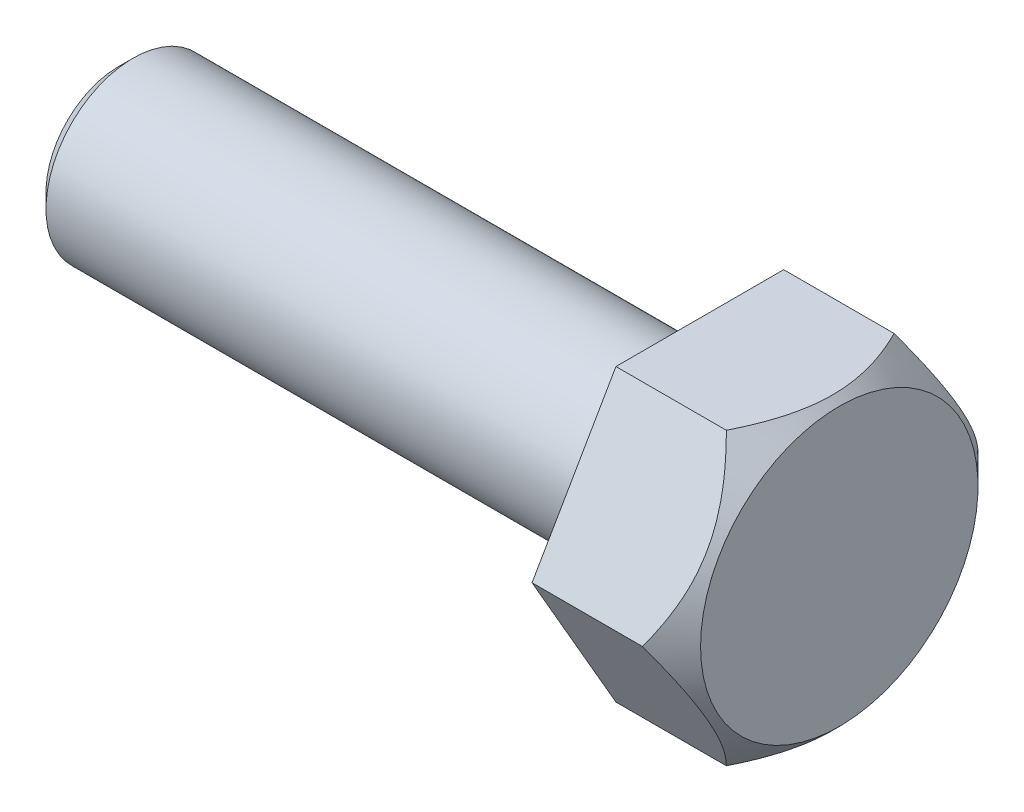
SolidWorks part; units mm, degrees
ref_plane "Plane1" through (0, 0, 0) normal (0, 0, 1) x (1, 0, 0)
ref_plane "Plane2" through (0, 0, 0) normal (0, 1, 0) x (1, 0, 0)
ref_plane "Plane3" through (0, 0, 0) normal (1, 0, 0) x (0, 0, -1)
sketch "Esquisse4" plane through (0, 0, 0) normal (1, 0, 0) x (0, 0, -1)
  circle A0 centre (0, 0) radius 3
  dimension "D1" = 6
extrude "Base-Extrusion" add sketch "Esquisse4" against normal blind 20
sketch "Esquisse7" plane through (0, 0, 0) normal (1, 0, 0) x (0, 0, -1)
  line L0 (-2.8868, 5) -> (2.8868, 5)
  line L1 (2.8868, 5) -> (5.7735, 0)
  line L2 (-2.8868, 5) -> (-5.7735, 0)
  line L3 (-2.8868, -5) -> (2.8868, -5)
  line L4 (5.7735, 0) -> (2.8868, -5)
  line L5 (-5.7735, 0) -> (-2.8868, -5)
  line L6 (0, 0) -> (6.308, 0) construction
  dimension "D2" = 120
  dimension "D3" = 120
  dimension "D4" = 120
  dimension "D5" = 120
  dimension "D6" = 120
extrude "Bossage-Extrusion1" add sketch "Esquisse7" along normal blind 4.8
chamfer "Chanfrein1" distance 0.5 angle 45
sketch "Esquisse12" plane through (0, 0, 0) normal (0, 1, 0) x (1, 0, 0)
  line L0 (4.8, 5.7735) -> (3.8, 5.7735)
  line L1 (4.8, 5.7735) -> (0, 5.7735) construction
  line L2 (3.8, 5.7735) -> (4.8, 4.7735)
  line L3 (4.8, 2.8868) -> (4.8, 5.7735) construction
  line L4 (4.8, 4.7735) -> (4.8, 5.7735)
  dimension "D1" = 1
  dimension "D2" = 1
sketch "Esquisse13" plane through (4.8, 0, 0) normal (1, 0, 0) x (0, 0, -1)
  circle A0 centre (0, 0) radius 5
  dimension "D1" = 10
sweep "Couper-Balayage2" cut profiles "Esquisse12" path "Esquisse13"
